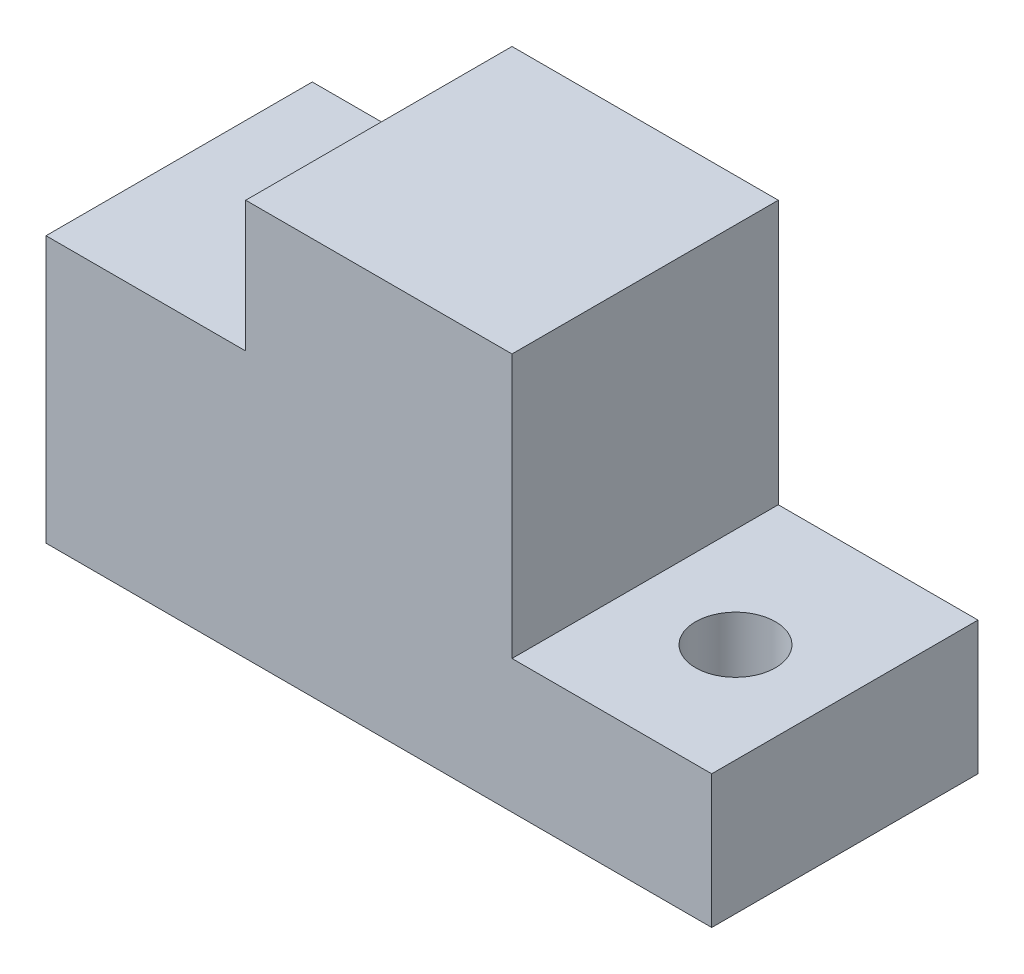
SolidWorks part; units mm, degrees
ref_plane "Plano frontal" through (0, 0, 0) normal (0, 0, 1) x (1, 0, 0)
ref_plane "Plano superior" through (0, 0, 0) normal (0, 1, 0) x (1, 0, 0)
ref_plane "Plano direito" through (0, 0, 0) normal (1, 0, 0) x (0, 0, -1)
sketch "Esboço1" plane through (0, 0, 0) normal (0, 0, 1) x (1, 0, 0)
  line L0 (0, 0) -> (0, -20)
  line L1 (0, -20) -> (50, -20)
  line L2 (0, 0) -> (15, 0)
  line L3 (50, -20) -> (50, -10)
  line L6 (15, 9.809) -> (15, 0)
  line L7 (15, 9.809) -> (35, 9.809)
  line L9 (50, -10) -> (35, -10)
  line L10 (35, 9.809) -> (35, -10)
  dimension "D1" = 20
  dimension "D2" = 50
  dimension "D3" = 10
  dimension "D4" = 15
  dimension "D5" = 20
extrude "Ressalto-extrusão1" add sketch "Esboço1" along normal blind 20
sketch "Esboço2" plane through (0, -10, 0) normal (0, 1, 0) x (1, 0, 0)
  circle A0 centre (42.5, -10.712) radius 3
  dimension "D1" = 6
extrude "Corte-extrusão1" cut sketch "Esboço2" against normal blind 20
